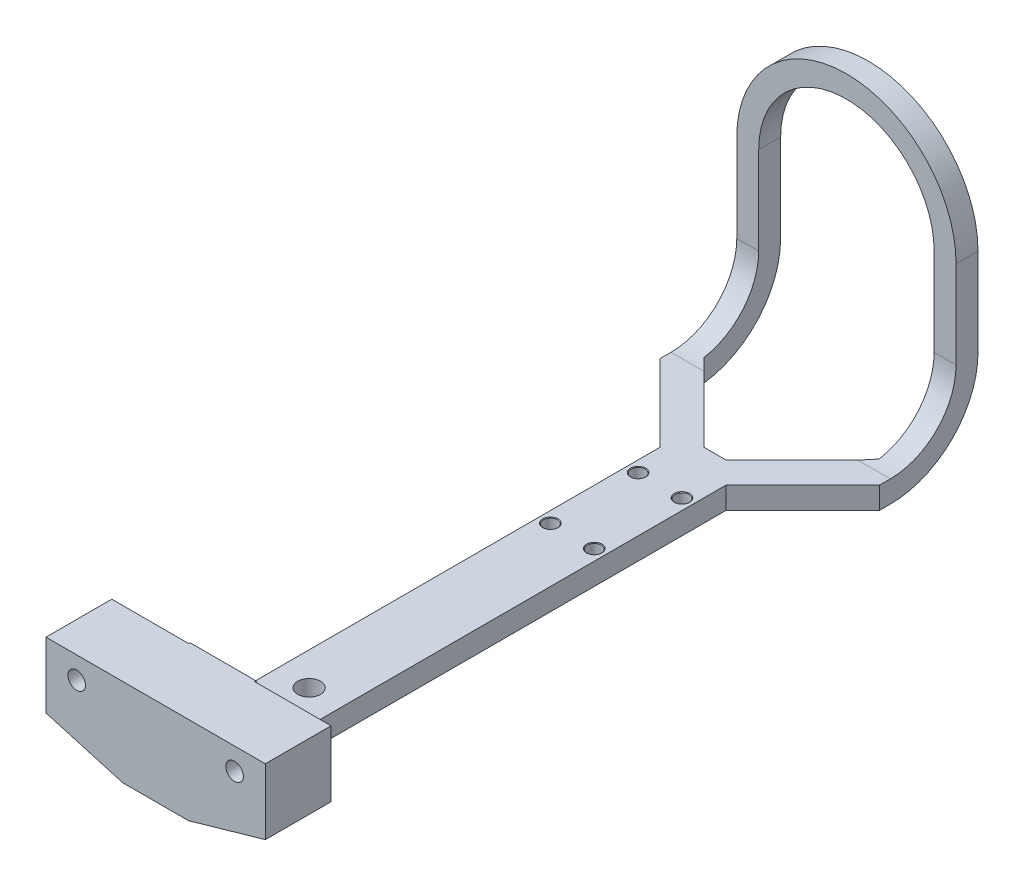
SolidWorks part; units mm, degrees
ref_plane "Front Plane" through (0, 0, 0) normal (0, 0, 1) x (1, 0, 0)
ref_plane "Top Plane" through (0, 0, 0) normal (0, 1, 0) x (1, 0, 0)
ref_plane "Right Plane" through (0, 0, 0) normal (1, 0, 0) x (0, 0, -1)
sketch "Sketch1" plane through (0, 0, 0) normal (0, 1, 0) x (1, 0, 0)
  line L0 (0, 0) -> (0, 12.5)
  line L1 (-5, 10) -> (5, 10)
  line L2 (-5, 10) -> (-5, -10)
  line L3 (-5, -10) -> (5, -10)
  line L4 (5, 10) -> (5, -10)
  line L5 (-5, 10) -> (5, -10) construction
  line L6 (-5, -10) -> (5, 10) construction
  line L7 (-7.5, 12.5) -> (7.5, 12.5)
  line L8 (-7.5, 12.5) -> (-7.5, -15)
  line L9 (-7.5, -15) -> (7.5, -15)
  line L10 (7.5, 12.5) -> (7.5, -15)
  point P0 (0, 0)
  point P6 (0, 0)
  dimension "D1" = 20
  dimension "D2" = 10
  dimension "D3" = 15
  dimension "D4" = 2.5
  dimension "D5" = 5
extrude "Boss-Extrude1" add sketch "Sketch1" along normal blind 5 contours L4 L1 L2 L3 | L10 L7 L8 L9 L1 L4 L3 L2
sketch "Sketch4" plane through (0, 5, 0) normal (0, 1, 0) x (1, 0, 0)
  line L1 (-5, 10) -> (5, 10)
  line L2 (-5, 10) -> (-5, -10)
  line L3 (-5, -10) -> (5, -10)
  line L4 (5, 10) -> (5, -10)
  line L5 (-5, 10) -> (5, -10) construction
  line L6 (-5, -10) -> (5, 10) construction
  point P0 (0, 0)
  dimension "D1" = 20
  dimension "D2" = 10
hole_wizard "Ø3.0mm Dowel Hole1" positions "Sketch4" profile "Sketch6" hole size "Ø3.0" standard "DIN"
sketch "Sketch6" plane through (5, 5, -10) normal (1, 0, 0) x (0, 0, 1)
  line L0 (0, 0) -> (0, 5)
  line L1 (0, 5) -> (1.6, 5)
  line L2 (1.6, 5) -> (1.6, 0.1259)
  line L3 (1.6, 0.1259) -> (1.75, 0)
  line L5 (1.75, 0) -> (0, 0)
  line L6 (-1.6, 0.1259) -> (-1.75, 0) construction
  line L11 (0, -6.35) -> (0, 107.95) construction
  dimension "Thru Hole Dia." = 3.2
  dimension "Thru Hole Depth" = 5
  dimension "Near C'Sink Dia." = 3.5
  dimension "Near C'Sink Angle" = 100
sketch "Sketch8" plane through (0, 5, 0) normal (0, 1, 0) x (1, 0, 0)
  line L0 (7.5, 12.5) -> (7.5, -15) construction
  line L1 (-7.5, -15) -> (7.5, -15)
  line L2 (-7.5, -15) -> (-7.5, -105)
  line L3 (-7.5, -105) -> (7.5, -105)
  line L4 (7.5, -15) -> (7.5, -105)
  dimension "D1" = 90
extrude "Boss-Extrude2" add sketch "Sketch8" against normal blind 5
sketch "Sketch9" plane through (0, 0, 0) normal (0, 1, 0) x (1, 0, 0)
  circle A0 centre (0, -70) radius 2.6
  circle A1 centre (-5, -10) radius 1.75 construction
  dimension "D1" = 5.2
  dimension "D2" = 60
extrude "Cut-Extrude1" cut sketch "Sketch9" along normal blind 11
sketch "Sketch11" plane through (0, 5, 0) normal (0, 1, 0) x (1, 0, 0)
  line L6 (-25, -90) -> (25, -90)
  line L7 (-25, -90) -> (-25, -105)
  line L8 (-25, -105) -> (25, -105)
  line L9 (25, -90) -> (25, -105)
  line L11 (-7.5, -105) -> (7.5, -105) construction
  line L12 (7.5, -105) -> (7.5, 12.5) construction
  dimension "D1" = 15
  dimension "D2" = 50
  dimension "D3" = 17.5
extrude "Boss-Extrude4" add sketch "Sketch11" along normal blind 15
chamfer "Chamfer1" distance 5 angle 74 2 edges at (7.5, 5, 97.5) (-7.5, 5, 97.5)
chamfer "Chamfer2" distance 7 angle 66 1 edges at (0, 5, 90)
sketch "Sketch12" plane through (0, 0, 105) normal (0, 0, 1) x (1, 0, 0)
  line L0 (-25, 20) -> (-25, 5) construction
  line L1 (-25, 20) -> (25, 20) construction
  circle A0 centre (-18, 15) radius 2
  circle A1 centre (18, 15) radius 2
  dimension "D1" = 4
  dimension "D2" = 36
  dimension "D3" = 7
  dimension "D4" = 5
extrude "Cut-Extrude2" cut sketch "Sketch12" against normal through all
sketch "Sketch13" plane through (0, 5, 0) normal (0, 1, 0) x (1, 0, 0)
  line L0 (-7.5, 12.5) -> (-7.5, -83) construction
  line L1 (7.5, 12.5) -> (-7.5, 12.5)
  line L2 (7.5, 12.5) -> (7.5, 22.5)
  line L3 (7.5, 22.5) -> (-7.5, 22.5)
  line L4 (-7.5, 12.5) -> (-7.5, 22.5)
  dimension "D1" = 10
extrude "Boss-Extrude5" add sketch "Sketch13" against normal blind 5
sketch "Sketch15" plane through (0, 5, 0) normal (0, 1, 0) x (1, 0, 0)
  line L0 (7.5, 22.5) -> (-7.5, 22.5) construction
  line L5 (25, 22.5) -> (-25, 22.5)
  line L6 (25, 22.5) -> (25, 17.5)
  line L11 (25, 17.5) -> (-25, 17.5)
  line L12 (-25, 22.5) -> (-25, 17.5)
  line L13 (0, 22.5) -> (0, 17.5) construction
  line L14 (25, 22.5) -> (20, 22.5)
  line L16 (25, 22.5) -> (25, 57.5)
  line L17 (25, 57.5) -> (20, 57.5)
  line L18 (20, 22.5) -> (20, 57.5)
  line L19 (-20, 22.5) -> (-20, 57.5)
  line L20 (-25, 57.5) -> (-20, 57.5)
  line L21 (-25, 22.5) -> (-25, 57.5)
  point P6 (0, 22.5)
  point P15 (0, 22.5)
  point P16 (0, 0)
  dimension "D1" = 5
  dimension "D2" = 50
  dimension "D3" = 5
  dimension "D4" = 40
extrude "Boss-Extrude7" add sketch "Sketch15" against normal blind 5 contours L21 L5 L19 L20 | L5 L12 L11 M22 | L11 L6 L5 M24 | L18 L5 L16 L17
sketch "Sketch16" plane through (0, 0, -57.5) normal (0, 0, -1) x (-1, 0, 0)
  line L1 (25, 0) -> (20, 0)
  line L2 (25, 0) -> (25, 40)
  line L3 (25, 40) -> (20, 40)
  line L4 (20, 0) -> (20, 40)
  line L5 (0, 0) -> (0, 46.1942) construction
  line L6 (-25, 40) -> (-20, 40)
  line L7 (-25, 0) -> (-25, 40)
  line L8 (-20, 0) -> (-20, 40)
  line L9 (-25, 0) -> (-20, 0)
  line L10 (20, 40) -> (-20, 40)
  line L11 (25, 0) -> (20, 0) construction
  circle A0 centre (0, 40) radius 20
  circle A1 centre (0, 40) radius 25
  point P5 (23.1732, 0)
  point P18 (25, 0)
  point P20 (20, 0)
  dimension "D1" = 40
extrude "Boss-Extrude8" add sketch "Sketch16" against normal blind 5
fillet "Fillet1" radius 15 2 edges at (22.5, 5, -52.5) (-22.5, 5, -52.5)
fillet "Fillet2" radius 20 2 edges at (-22.5, 0, -57.5) (22.5, 0, -57.5)
chamfer "Chamfer3" distance 17.5 angle 45 4 edges at (-25, 2.5, -17.5) (-20, 2.5, -22.5) (25, 2.5, -17.5) (20, 2.5, -22.5)
